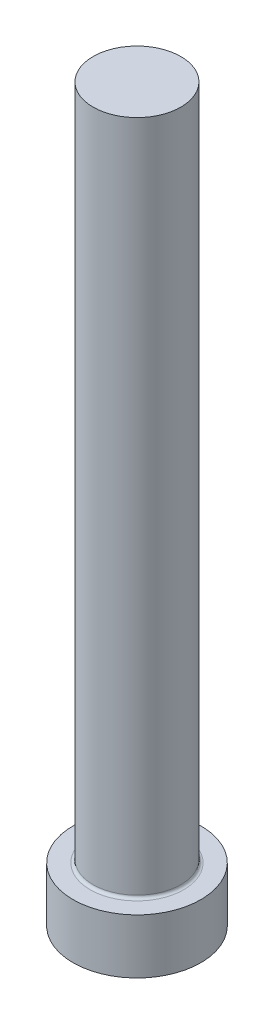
SolidWorks part; units mm, degrees
ref_plane "Front Plane" through (0, 0, 0) normal (0, 0, 1) x (1, 0, 0)
ref_plane "Top Plane" through (0, 0, 0) normal (0, 1, 0) x (1, 0, 0)
ref_plane "Right Plane" through (0, 0, 0) normal (1, 0, 0) x (0, 0, -1)
sketch "Sketch1" plane through (0, 0, 0) normal (0, 0, 1) x (1, 0, 0)
  line L0 (0, 0) -> (0, -1.906) construction
  line L1 (0, 0) -> (5.5499, 0)
  line L2 (5.5499, 0) -> (5.5499, 4.7498)
  line L3 (5.5499, 4.7498) -> (4.064, 4.7498)
  line L4 (3.81, 5.0038) -> (3.81, 63.5)
  line L6 (0, 63.5) -> (3.81, 63.5)
  line L7 (0, 63.5) -> (0, 0)
  arc A0 (4.064, 4.7498) -> (3.81, 5.0038) centre (4.064, 5.0038) cw
  dimension "D5" = 0.254
  dimension "D" = 7.62
  dimension "H" = 11.0998
  dimension "D4" = 63.5
  dimension "T" = 4.7498
revolve "Revolve3" add sketch "Sketch1" angle 360 about L0
